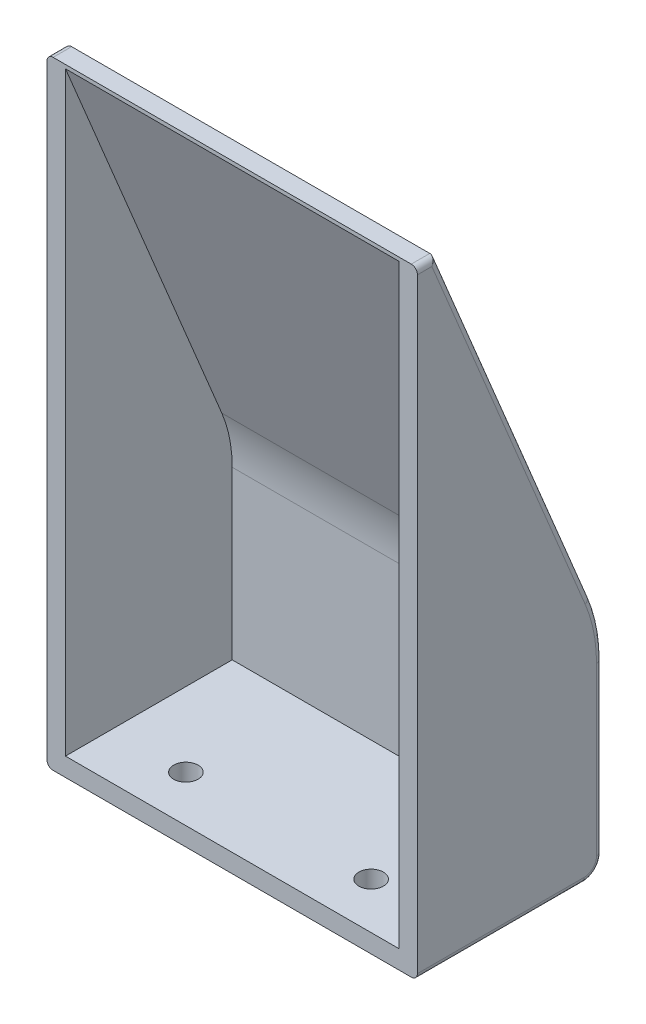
SolidWorks part; units mm, degrees
ref_plane "Front Plane" through (0, 0, 0) normal (0, 0, 1) x (1, 0, 0)
ref_plane "Top Plane" through (0, 0, 0) normal (0, 1, 0) x (1, 0, 0)
ref_plane "Right Plane" through (0, 0, 0) normal (1, 0, 0) x (0, 0, -1)
sketch "Sketch1" plane through (0, 0, 0) normal (0, 1, 0) x (1, 0, 0)
  line L1 (60, -30) -> (-60, -30)
  line L2 (60, -30) -> (60, 30)
  line L3 (60, 30) -> (-60, 30)
  line L4 (-60, -30) -> (-60, 30)
  line L5 (60, -30) -> (-60, 30) construction
  line L6 (60, 30) -> (-60, -30) construction
  point P0 (0, 0)
  dimension "D1" = 120
  dimension "D2" = 60
extrude "Boss-Extrude1" add sketch "Sketch1" along normal blind 200
sketch "Sketch2" plane through (-60, 0, 0) normal (-1, 0, 0) x (0, 0, 1)
  line L0 (24, 200) -> (-30, 70)
  line L1 (-30, 200) -> (-30, 0) construction
  line L2 (-30, 70) -> (-30, 200)
  line L3 (-30, 200) -> (30, 200) construction
  line L4 (-30, 200) -> (24, 200)
  dimension "D1" = 70
  dimension "D2" = 6
extrude "Cut-Extrude1" cut sketch "Sketch2" against normal through all
fillet "Fillet1" radius 50 1 edges at (0, 70, -30)
fillet "Fillet3" radius 6 1 edges at (0, 0, -30)
fillet "Fillet2" radius 2 12 edges at (60, 200, 27) (-60, 200, 27) (60, 0, 3) (-60, 0, 3) (60, 139.6044, -1.0874) (60, 69.8074, -29.0344) (60, 33.0142, -30) (60, 1.7574, -28.2426) (-60, 139.6044, -1.0874) (-60, 69.8074, -29.0344) (-60, 33.0142, -30) (-60, 1.7574, -28.2426)
shell "Shell1" thickness 6
sketch "Sketch3" plane through (0, 6, 0) normal (0, 1, 0) x (1, 0, 0)
  line L0 (-30, -15) -> (30, -15) construction
  line L1 (0, 0) -> (0, -15) construction
  dimension "D1" = 60
  dimension "D2" = 15
hole_wizard "5/16 (0.3125) Diameter Hole1" positions "Sketch5" profile "Sketch4" hole size "5/16" standard "Ansi Inch"
sketch "Sketch5" plane through (0, 6, 0) normal (0, 1, 0) x (-1, 0, 0)
  point P0 (30, 15)
  point P1 (-30, 15)
sketch "Sketch4" plane through (-30, 6, 15) normal (1, 0, 0) x (0, 0, 1)
  line L0 (0, 0) -> (0, 12.3847)
  line L1 (0, 12.3847) -> (3.9687, 10)
  line L2 (3.9687, 10) -> (3.9688, 0)
  line L5 (3.9688, 0) -> (0, 0)
  line L10 (0, 12.3847) -> (-3.9688, 10) construction
  line L11 (0, -6.35) -> (0, 107.95) construction
  dimension "Hole Dia." = 7.9375
  dimension "Hole Depth" = 10
  dimension "Drill Angle" = 118
